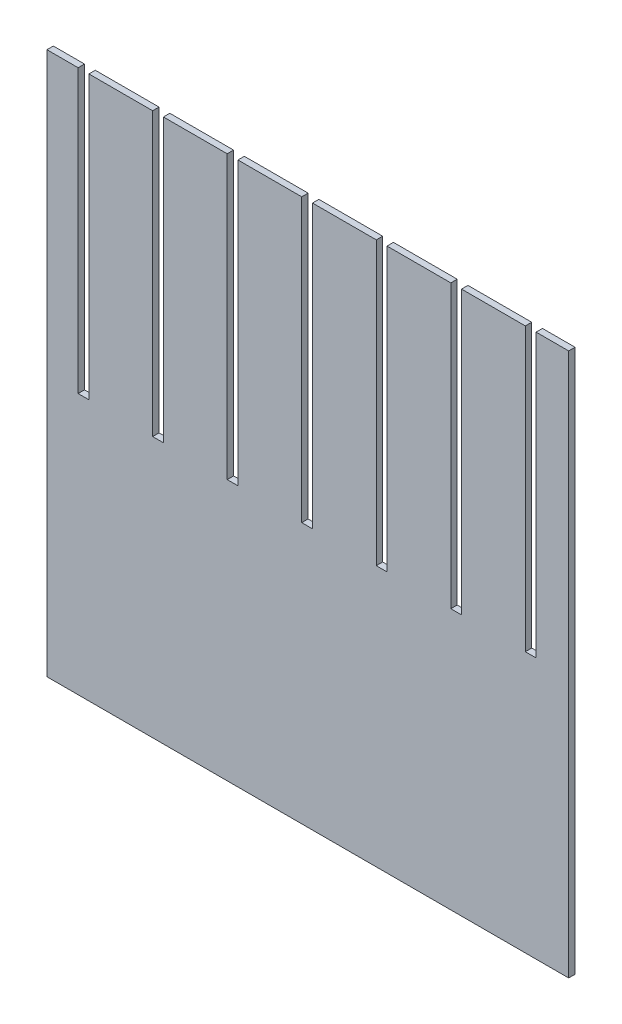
SolidWorks part; units mm, degrees
ref_plane "Спереди" through (0, 0, 0) normal (0, 0, 1) x (1, 0, 0)
ref_plane "Сверху" through (0, 0, 0) normal (0, 1, 0) x (1, 0, 0)
ref_plane "Справа" through (0, 0, 0) normal (1, 0, 0) x (0, 0, -1)
other "Configuration Table"
sketch "Эскиз1" plane through (0, 0, 0) normal (0, 0, 1) x (1, 0, 0)
  line L1 (-2.93, 25.5) -> (46.07, 25.5)
  line L2 (-2.93, 25.5) -> (-2.93, -25.5)
  line L3 (-2.93, -25.5) -> (46.07, -25.5)
  line L4 (46.07, 25.5) -> (46.07, -25.5)
  point P4 (-2.93, 0)
  dimension "D1" = 51
  dimension "D2" = 49
  dimension "D3" = 2.93
extrude "Бобышка-Вытянуть1" add sketch "Эскиз1" along normal blind 0.6
sketch "Эскиз3" plane through (0, 0, 0) normal (0, 0, 1) x (1, 0, 0)
  line L0 (46.07, 25.5) -> (-2.93, 25.5) construction
  line L1 (0, 25.5) -> (1.01, 25.5)
  line L2 (0, 25.5) -> (0, -1)
  line L3 (0, -1) -> (1.01, -1)
  line L4 (1.01, 25.5) -> (1.01, -1)
  dimension "D1" = 1.01
  dimension "D2" = 1
extrude "Вырез-Вытянуть1" cut sketch "Эскиз3" along normal through all both and the other way through all
pattern_linear "Линейный массив1" count 7 spacing 7 along (1, 0, 0) of "Вырез-Вытянуть1"
